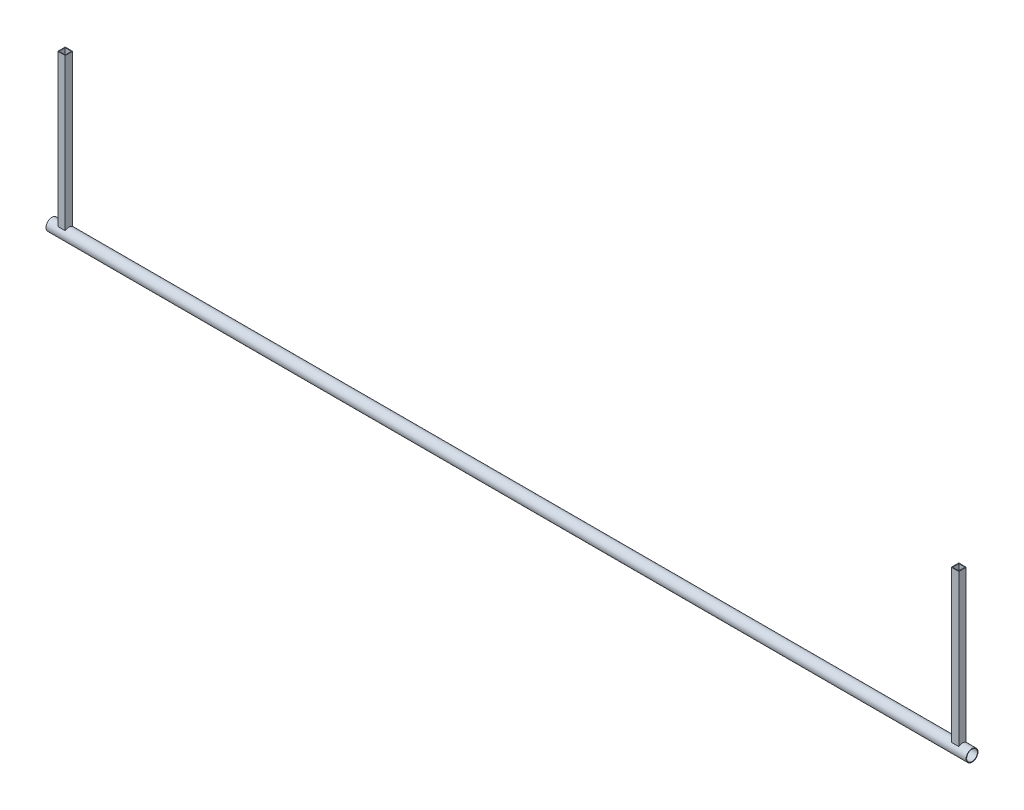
SolidWorks part; units mm, degrees
ref_plane "Plan de face" through (0, 0, 0) normal (0, 0, 1) x (1, 0, 0)
ref_plane "Plan de dessus" through (0, 0, 0) normal (0, 1, 0) x (1, 0, 0)
ref_plane "Plan de droite" through (0, 0, 0) normal (1, 0, 0) x (0, 0, -1)
sketch "Esquisse1" plane through (0, 0, 0) normal (1, 0, 0) x (0, 0, -1)
  circle A0 centre (0, 0) radius 20
  dimension "D1" = 40
extrude "Boss.-Extru.1" add sketch "Esquisse1" along normal blind 3090
sketch "Esquisse2" plane through (0, 0, 0) normal (0, 1, 0) x (1, 0, 0)
  line L1 (32, -12.5) -> (57, -12.5)
  line L2 (32, -12.5) -> (32, 12.5)
  line L3 (32, 12.5) -> (57, 12.5)
  line L4 (57, -12.5) -> (57, 12.5)
  line L5 (3058, -12.5) -> (3033, -12.5)
  line L6 (3058, -12.5) -> (3058, 12.5)
  line L7 (3058, 12.5) -> (3033, 12.5)
  line L8 (3033, -12.5) -> (3033, 12.5)
  line L9 (3035, -10.5) -> (3056, -10.5)
  line L10 (3035, -10.5) -> (3035, 10.5)
  line L11 (3035, 10.5) -> (3056, 10.5)
  line L12 (3056, -10.5) -> (3056, 10.5)
  line L13 (34, -10.5) -> (55, -10.5)
  line L14 (34, -10.5) -> (34, 10.5)
  line L15 (34, 10.5) -> (55, 10.5)
  line L16 (55, -10.5) -> (55, 10.5)
  dimension "D1" = 25
  dimension "D2" = 25
  dimension "D3" = 25
  dimension "D4" = 25
  dimension "D5" = 12.5
  dimension "D6" = 12.5
  dimension "D7" = 32
  dimension "D8" = 32
  dimension "D9" = 2
  dimension "D10" = 2
  dimension "D11" = 2
  dimension "D12" = 2
  dimension "D13" = 2
  dimension "D14" = 2
  dimension "D15" = 2
  dimension "D16" = 2
extrude "Boss.-Extru.2" add sketch "Esquisse2" along normal blind 525
sketch "Esquisse3" plane through (0, 0, 0) normal (-1, 0, 0) x (0, 0, 1)
  circle A0 centre (0, 0) radius 18
  dimension "D1" = 36
extrude "Enlèv. mat.-Extru.1" cut sketch "Esquisse3" against normal through all
